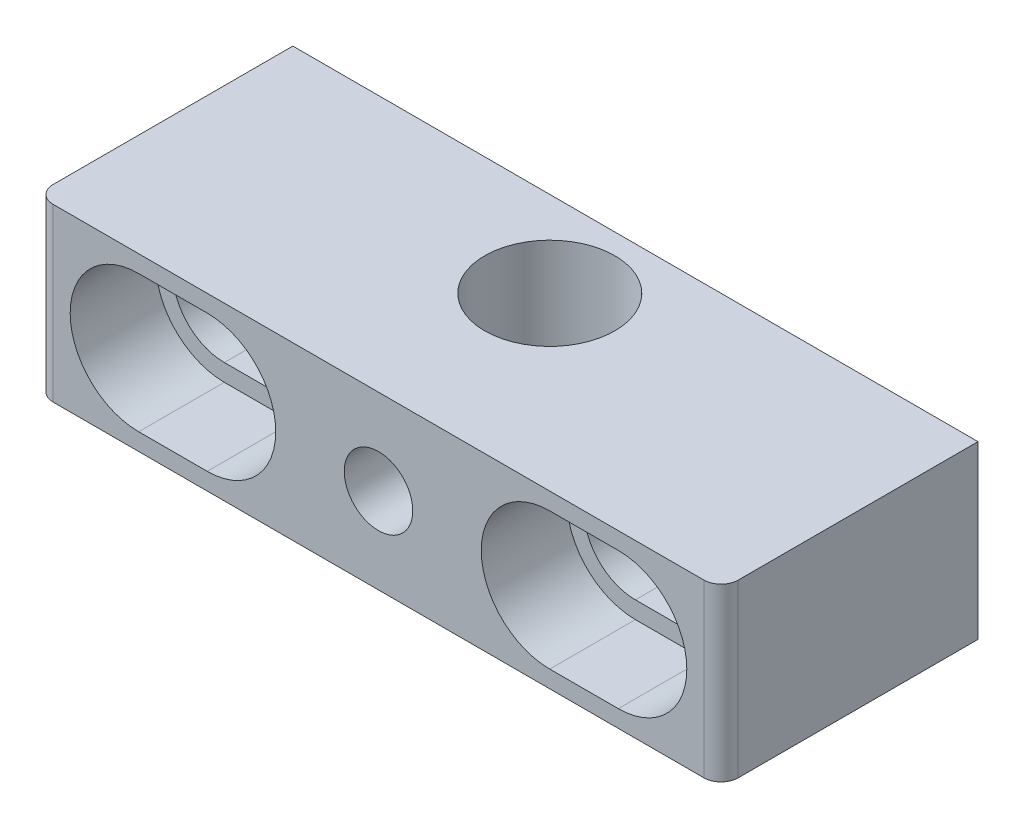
SolidWorks part; units mm, degrees
ref_plane "Front Plane" through (0, 0, 0) normal (0, 0, 1) x (1, 0, 0)
ref_plane "Top Plane" through (0, 0, 0) normal (0, 1, 0) x (1, 0, 0)
ref_plane "Right Plane" through (0, 0, 0) normal (1, 0, 0) x (0, 0, -1)
sketch "Sketch1" plane through (0, 0, 0) normal (0, 0, 1) x (1, 0, 0)
  line L0 (0, -1000) -> (0, 49000) construction
  line L1 (-25.4, -6.35) -> (25.4, -6.35)
  line L2 (-25.4, -6.35) -> (-25.4, 6.35)
  line L3 (-25.4, 6.35) -> (25.4, 6.35)
  line L4 (25.4, -6.35) -> (25.4, 6.35)
  line L5 (-25.4, -6.35) -> (25.4, 6.35) construction
  line L6 (-25.4, 6.35) -> (25.4, -6.35) construction
  line L7 (-1000, 0) -> (49000, 0) construction
  line L8 (-17.78, 0) -> (-12.7, 0) construction
  line L9 (-17.78, 5.08) -> (-12.7, 5.08)
  line L10 (-17.78, -5.08) -> (-12.7, -5.08)
  line L11 (17.78, 0) -> (12.7, 0) construction
  line L12 (17.78, 5.08) -> (12.7, 5.08)
  line L13 (17.78, -5.08) -> (12.7, -5.08)
  arc A0 (-17.78, 5.08) -> (-17.78, -5.08) centre (-17.78, 0) ccw
  arc A1 (-12.7, -5.08) -> (-12.7, 5.08) centre (-12.7, 0) ccw
  arc A2 (17.78, 5.08) -> (17.78, -5.08) centre (17.78, 0) cw
  arc A3 (12.7, -5.08) -> (12.7, 5.08) centre (12.7, 0) cw
  point P0 (0, 0)
  point P12 (-15.24, 0)
  point P19 (15.24, 0)
  dimension "D5" = 5.08
  dimension "D1" = 50.8
  dimension "D2" = 12.7
  dimension "D3" = 7.62
  dimension "D4" = 12.7
extrude "Boss-Extrude1" add sketch "Sketch1" along normal blind 6.35
sketch "Sketch2" plane through (0, 0, 0) normal (0, 0, -1) x (-1, 0, 0)
  line L0 (-17.78, 0) -> (-12.7, 0) construction
  line L1 (-25.4, -6.35) -> (25.4, -6.35)
  line L2 (-25.4, -6.35) -> (-25.4, 6.35)
  line L3 (-25.4, 6.35) -> (25.4, 6.35)
  line L4 (25.4, -6.35) -> (25.4, 6.35)
  line L5 (-25.4, -6.35) -> (25.4, 6.35) construction
  line L6 (-25.4, 6.35) -> (25.4, -6.35) construction
  line L7 (-17.78, 3.81) -> (-12.7, 3.81)
  line L8 (-17.78, -3.81) -> (-12.7, -3.81)
  line L9 (0, -1000) -> (0, 49000) construction
  line L10 (17.78, 0) -> (12.7, 0) construction
  line L11 (17.78, 3.81) -> (12.7, 3.81)
  line L12 (17.78, -3.81) -> (12.7, -3.81)
  arc A0 (-17.78, 3.81) -> (-17.78, -3.81) centre (-17.78, 0) ccw
  arc A1 (-12.7, -3.81) -> (-12.7, 3.81) centre (-12.7, 0) ccw
  arc A2 (17.78, 3.81) -> (17.78, -3.81) centre (17.78, 0) cw
  arc A3 (12.7, -3.81) -> (12.7, 3.81) centre (12.7, 0) cw
  point P0 (0, 0)
  point P11 (-15.24, 0)
  point P20 (15.24, 0)
  dimension "D1" = 3.81
extrude "Boss-Extrude2" add sketch "Sketch2" along normal blind 12.7
fillet "Fillet1" radius 1.27 2 edges at (-25.4, 0, 6.35) (25.4, 0, 6.35)
sketch "Sketch3" plane through (0, 6.35, 0) normal (0, 1, 0) x (1, 0, 0)
  line L0 (24.13, -6.35) -> (-24.13, -6.35) construction
  circle A0 centre (0, 6.35) radius 4.826
  dimension "D1" = 9.652
  dimension "D2" = 12.7
extrude "Cut-Extrude1" cut sketch "Sketch3" against normal blind 12.7
sketch "Sketch4" plane through (0, 0, 6.35) normal (0, 0, 1) x (1, 0, 0)
  circle A0 centre (0, 0) radius 2.54
  dimension "D1" = 5.08
extrude "Cut-Extrude2" cut sketch "Sketch4" against normal blind 12.7
